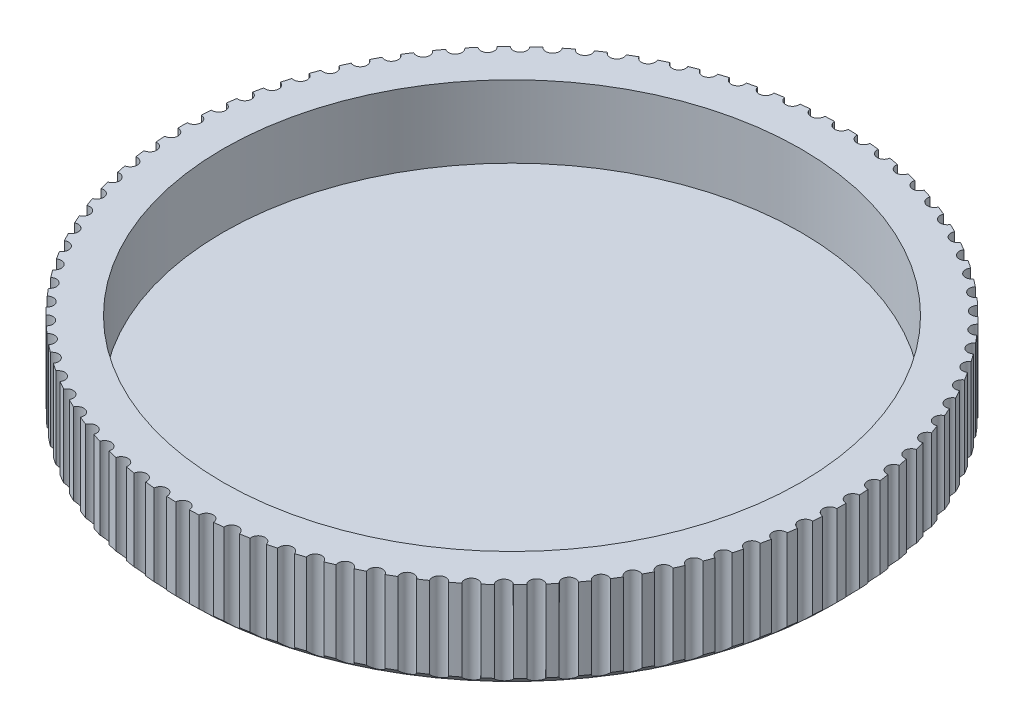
SolidWorks part; units mm, degrees
ref_plane "Front Plane" through (0, 0, 0) normal (0, 0, 1) x (1, 0, 0)
ref_plane "Top Plane" through (0, 0, 0) normal (0, 1, 0) x (1, 0, 0)
ref_plane "Right Plane" through (0, 0, 0) normal (1, 0, 0) x (0, 0, -1)
sketch "Sketch1" plane through (0, 0, 0) normal (0, 1, 0) x (1, 0, 0)
  circle A0 centre (0, 0) radius 36.5
  dimension "D1" = 73
extrude "Boss-Extrude1" add sketch "Sketch1" along normal mid plane 10 contours A0
sketch "Sketch3" plane through (0, 5, 0) normal (0, 1, 0) x (1, 0, 0)
  circle A0 centre (0, 0) radius 32
  dimension "D1" = 64
extrude "Cut-Extrude1" cut sketch "Sketch3" against normal blind 8
chamfer "Chamfer1" distance 1 angle 45 1 edges at (0, -5, 36.5)
sketch "Sketch12" plane through (0, 5, 0) normal (0, 1, 0) x (1, 0, 0)
  line L0 (0, 0) -> (0, 50.0582) construction
  line L1 (0.7532, 36.4922) -> (-0.7532, 36.4922)
  line L2 (3.2969, 36.3508) -> (1.7942, 36.4559)
  line L3 (5.8246, 36.0323) -> (4.3329, 36.2419)
  line L4 (8.3239, 35.5382) -> (6.8504, 35.8514)
  line L5 (10.7826, 34.871) -> (9.3346, 35.2862)
  line L6 (13.1888, 34.0339) -> (11.7733, 34.5491)
  line L7 (15.5308, 33.031) -> (14.1547, 33.6437)
  line L8 (17.7971, 31.8671) -> (16.467, 32.5743)
  line L9 (19.9767, 30.548) -> (18.6992, 31.3463)
  line L10 (22.0589, 29.0801) -> (20.8403, 29.9655)
  line L11 (24.0337, 27.4705) -> (22.8798, 28.4388)
  line L12 (25.8914, 25.7271) -> (24.8078, 26.7735)
  line L13 (27.623, 23.8583) -> (26.615, 24.9778)
  line L14 (29.22, 21.8733) -> (28.2926, 23.0604)
  line L15 (30.6746, 19.7818) -> (29.8323, 21.0306)
  line L16 (31.9798, 17.5938) -> (31.2266, 18.8984)
  line L17 (33.1292, 15.3202) -> (32.4688, 16.6741)
  line L18 (34.1172, 12.9719) -> (33.5529, 14.3686)
  line L19 (34.9389, 10.5604) -> (34.4734, 11.993)
  line L20 (35.5905, 8.0975) -> (35.226, 9.5591)
  line L21 (36.0686, 5.5951) -> (35.807, 7.0786)
  line L22 (36.371, 3.0654) -> (36.2136, 4.5635)
  line L23 (36.4963, 0.5208) -> (36.4437, 2.0263)
  line L24 (36.4437, -2.0263) -> (36.4963, -0.5208)
  line L25 (36.2136, -4.5635) -> (36.371, -3.0654)
  line L26 (35.807, -7.0786) -> (36.0686, -5.5951)
  line L27 (35.226, -9.5591) -> (35.5905, -8.0975)
  line L28 (34.4734, -11.993) -> (34.9389, -10.5604)
  line L29 (33.5529, -14.3686) -> (34.1172, -12.9719)
  line L30 (32.4688, -16.6741) -> (33.1292, -15.3202)
  line L31 (31.2266, -18.8984) -> (31.9798, -17.5938)
  line L32 (29.8323, -21.0306) -> (30.6746, -19.7818)
  line L33 (28.2926, -23.0604) -> (29.22, -21.8733)
  line L34 (26.615, -24.9778) -> (27.623, -23.8583)
  line L35 (24.8078, -26.7735) -> (25.8914, -25.7271)
  line L36 (22.8798, -28.4388) -> (24.0337, -27.4705)
  line L37 (20.8403, -29.9655) -> (22.0589, -29.0801)
  line L38 (18.6992, -31.3463) -> (19.9767, -30.548)
  line L39 (16.467, -32.5743) -> (17.7971, -31.8671)
  line L40 (14.1547, -33.6437) -> (15.5308, -33.031)
  line L41 (11.7733, -34.5491) -> (13.1888, -34.0339)
  line L42 (9.3346, -35.2862) -> (10.7826, -34.871)
  line L43 (6.8504, -35.8514) -> (8.3239, -35.5382)
  line L44 (4.3329, -36.2419) -> (5.8246, -36.0323)
  line L45 (1.7942, -36.4559) -> (3.2969, -36.3508)
  line L46 (-0.7532, -36.4922) -> (0.7532, -36.4922)
  line L47 (-3.2969, -36.3508) -> (-1.7942, -36.4559)
  line L48 (-5.8246, -36.0323) -> (-4.3329, -36.2419)
  line L49 (-8.3239, -35.5382) -> (-6.8504, -35.8514)
  line L50 (-10.7826, -34.871) -> (-9.3346, -35.2862)
  line L51 (-13.1888, -34.0339) -> (-11.7733, -34.5491)
  line L52 (-15.5308, -33.031) -> (-14.1547, -33.6437)
  line L53 (-17.7971, -31.8671) -> (-16.467, -32.5743)
  line L54 (-19.9767, -30.548) -> (-18.6992, -31.3463)
  line L55 (-22.0589, -29.0801) -> (-20.8403, -29.9655)
  line L56 (-24.0337, -27.4705) -> (-22.8798, -28.4388)
  line L57 (-25.8914, -25.7271) -> (-24.8078, -26.7735)
  line L58 (-27.623, -23.8583) -> (-26.615, -24.9778)
  line L59 (-29.22, -21.8733) -> (-28.2926, -23.0604)
  line L60 (-30.6746, -19.7818) -> (-29.8323, -21.0306)
  line L61 (-31.9798, -17.5938) -> (-31.2266, -18.8984)
  line L62 (-33.1292, -15.3202) -> (-32.4688, -16.6741)
  line L63 (-34.1172, -12.9719) -> (-33.5529, -14.3686)
  line L64 (-34.9389, -10.5604) -> (-34.4734, -11.993)
  line L65 (-35.5905, -8.0975) -> (-35.226, -9.5591)
  line L66 (-36.0686, -5.5951) -> (-35.807, -7.0786)
  line L67 (-36.371, -3.0654) -> (-36.2136, -4.5635)
  line L68 (-36.4963, -0.5208) -> (-36.4437, -2.0263)
  line L69 (-36.4437, 2.0263) -> (-36.4963, 0.5208)
  line L70 (-36.2136, 4.5635) -> (-36.371, 3.0654)
  line L71 (-35.807, 7.0786) -> (-36.0686, 5.5951)
  line L72 (-35.226, 9.5591) -> (-35.5905, 8.0975)
  line L73 (-34.4734, 11.993) -> (-34.9389, 10.5604)
  line L74 (-33.5529, 14.3686) -> (-34.1172, 12.9719)
  line L75 (-32.4688, 16.6741) -> (-33.1292, 15.3202)
  line L76 (-31.2266, 18.8984) -> (-31.9798, 17.5938)
  line L77 (-29.8323, 21.0306) -> (-30.6746, 19.7818)
  line L78 (-28.2926, 23.0604) -> (-29.22, 21.8733)
  line L79 (-26.615, 24.9778) -> (-27.623, 23.8583)
  line L80 (-24.8078, 26.7735) -> (-25.8914, 25.7271)
  line L81 (-22.8798, 28.4388) -> (-24.0337, 27.4705)
  line L82 (-20.8403, 29.9655) -> (-22.0589, 29.0801)
  line L83 (-18.6992, 31.3463) -> (-19.9767, 30.548)
  line L84 (-16.467, 32.5743) -> (-17.7971, 31.8671)
  line L85 (-14.1547, 33.6437) -> (-15.5308, 33.031)
  line L86 (-11.7733, 34.5491) -> (-13.1888, 34.0339)
  line L87 (-9.3346, 35.2862) -> (-10.7826, 34.871)
  line L88 (-6.8504, 35.8514) -> (-8.3239, 35.5382)
  line L89 (-4.3329, 36.2419) -> (-5.8246, 36.0323)
  line L90 (-1.7942, 36.4559) -> (-3.2969, 36.3508)
  arc A0 (-0.7532, 36.4922) -> (0.7532, 36.4922) centre (0, 36.5) ccw
  circle A1 centre (0, 0) radius 36.5 construction
  arc A2 (1.7942, 36.4559) -> (3.2969, 36.3508) centre (2.5461, 36.4111) ccw
  arc A3 (4.3329, 36.2419) -> (5.8246, 36.0323) centre (5.0798, 36.1448) ccw
  arc A4 (6.8504, 35.8514) -> (8.3239, 35.5382) centre (7.5888, 35.7024) ccw
  arc A5 (9.3346, 35.2862) -> (10.7826, 34.871) centre (10.0608, 35.0861) ccw
  arc A6 (11.7733, 34.5491) -> (13.1888, 34.0339) centre (12.4837, 34.2988) ccw
  arc A7 (14.1547, 33.6437) -> (15.5308, 33.031) centre (14.8459, 33.3444) ccw
  arc A8 (16.467, 32.5743) -> (17.7971, 31.8671) centre (17.1357, 32.2276) ccw
  arc A9 (18.6992, 31.3463) -> (19.9767, 30.548) centre (19.3421, 30.9538) ccw
  arc A10 (20.8403, 29.9655) -> (22.0589, 29.0801) centre (21.4542, 29.5291) ccw
  arc A11 (22.8798, 28.4388) -> (24.0337, 27.4705) centre (23.4617, 27.9606) ccw
  arc A12 (24.8078, 26.7735) -> (25.8914, 25.7271) centre (25.355, 26.2559) ccw
  arc A13 (26.615, 24.9778) -> (27.623, 23.8583) centre (27.1248, 24.4233) ccw
  arc A14 (28.2926, 23.0604) -> (29.22, 21.8733) centre (28.7624, 22.4716) ccw
  arc A15 (29.8323, 21.0306) -> (30.6746, 19.7818) centre (30.2599, 20.4105) ccw
  arc A16 (31.2266, 18.8984) -> (31.9798, 17.5938) centre (31.6099, 18.25) ccw
  arc A17 (32.4688, 16.6741) -> (33.1292, 15.3202) centre (32.806, 16.0005) ccw
  arc A18 (33.5529, 14.3686) -> (34.1172, 12.9719) centre (33.8422, 13.6731) ccw
  arc A19 (34.4734, 11.993) -> (34.9389, 10.5604) centre (34.7136, 11.2791) ccw
  arc A20 (35.226, 9.5591) -> (35.5905, 8.0975) centre (35.4158, 8.8301) ccw
  arc A21 (35.807, 7.0786) -> (36.0686, 5.5951) centre (35.9455, 6.3382) ccw
  arc A22 (36.2136, 4.5635) -> (36.371, 3.0654) centre (36.3, 3.8153) ccw
  arc A23 (36.4437, 2.0263) -> (36.4963, 0.5208) centre (36.4778, 1.2738) ccw
  arc A24 (36.4963, -0.5208) -> (36.4437, -2.0263) centre (36.4778, -1.2738) ccw
  arc A25 (36.371, -3.0654) -> (36.2136, -4.5635) centre (36.3, -3.8153) ccw
  arc A26 (36.0686, -5.5951) -> (35.807, -7.0786) centre (35.9455, -6.3382) ccw
  arc A27 (35.5905, -8.0975) -> (35.226, -9.5591) centre (35.4158, -8.8301) ccw
  arc A28 (34.9389, -10.5604) -> (34.4734, -11.993) centre (34.7136, -11.2791) ccw
  arc A29 (34.1172, -12.9719) -> (33.5529, -14.3686) centre (33.8422, -13.6731) ccw
  arc A30 (33.1292, -15.3202) -> (32.4688, -16.6741) centre (32.806, -16.0005) ccw
  arc A31 (31.9798, -17.5938) -> (31.2266, -18.8984) centre (31.6099, -18.25) ccw
  arc A32 (30.6746, -19.7818) -> (29.8323, -21.0306) centre (30.2599, -20.4105) ccw
  arc A33 (29.22, -21.8733) -> (28.2926, -23.0604) centre (28.7624, -22.4716) ccw
  arc A34 (27.623, -23.8583) -> (26.615, -24.9778) centre (27.1248, -24.4233) ccw
  arc A35 (25.8914, -25.7271) -> (24.8078, -26.7735) centre (25.355, -26.2559) ccw
  arc A36 (24.0337, -27.4705) -> (22.8798, -28.4388) centre (23.4617, -27.9606) ccw
  arc A37 (22.0589, -29.0801) -> (20.8403, -29.9655) centre (21.4542, -29.5291) ccw
  arc A38 (19.9767, -30.548) -> (18.6992, -31.3463) centre (19.3421, -30.9538) ccw
  arc A39 (17.7971, -31.8671) -> (16.467, -32.5743) centre (17.1357, -32.2276) ccw
  arc A40 (15.5308, -33.031) -> (14.1547, -33.6437) centre (14.8459, -33.3444) ccw
  arc A41 (13.1888, -34.0339) -> (11.7733, -34.5491) centre (12.4837, -34.2988) ccw
  arc A42 (10.7826, -34.871) -> (9.3346, -35.2862) centre (10.0608, -35.0861) ccw
  arc A43 (8.3239, -35.5382) -> (6.8504, -35.8514) centre (7.5888, -35.7024) ccw
  arc A44 (5.8246, -36.0323) -> (4.3329, -36.2419) centre (5.0798, -36.1448) ccw
  arc A45 (3.2969, -36.3508) -> (1.7942, -36.4559) centre (2.5461, -36.4111) ccw
  arc A46 (0.7532, -36.4922) -> (-0.7532, -36.4922) centre (0, -36.5) ccw
  arc A47 (-1.7942, -36.4559) -> (-3.2969, -36.3508) centre (-2.5461, -36.4111) ccw
  arc A48 (-4.3329, -36.2419) -> (-5.8246, -36.0323) centre (-5.0798, -36.1448) ccw
  arc A49 (-6.8504, -35.8514) -> (-8.3239, -35.5382) centre (-7.5888, -35.7024) ccw
  arc A50 (-9.3346, -35.2862) -> (-10.7826, -34.871) centre (-10.0608, -35.0861) ccw
  arc A51 (-11.7733, -34.5491) -> (-13.1888, -34.0339) centre (-12.4837, -34.2988) ccw
  arc A52 (-14.1547, -33.6437) -> (-15.5308, -33.031) centre (-14.8459, -33.3444) ccw
  arc A53 (-16.467, -32.5743) -> (-17.7971, -31.8671) centre (-17.1357, -32.2276) ccw
  arc A54 (-18.6992, -31.3463) -> (-19.9767, -30.548) centre (-19.3421, -30.9538) ccw
  arc A55 (-20.8403, -29.9655) -> (-22.0589, -29.0801) centre (-21.4542, -29.5291) ccw
  arc A56 (-22.8798, -28.4388) -> (-24.0337, -27.4705) centre (-23.4617, -27.9606) ccw
  arc A57 (-24.8078, -26.7735) -> (-25.8914, -25.7271) centre (-25.355, -26.2559) ccw
  arc A58 (-26.615, -24.9778) -> (-27.623, -23.8583) centre (-27.1248, -24.4233) ccw
  arc A59 (-28.2926, -23.0604) -> (-29.22, -21.8733) centre (-28.7624, -22.4716) ccw
  arc A60 (-29.8323, -21.0306) -> (-30.6746, -19.7818) centre (-30.2599, -20.4105) ccw
  arc A61 (-31.2266, -18.8984) -> (-31.9798, -17.5938) centre (-31.6099, -18.25) ccw
  arc A62 (-32.4688, -16.6741) -> (-33.1292, -15.3202) centre (-32.806, -16.0005) ccw
  arc A63 (-33.5529, -14.3686) -> (-34.1172, -12.9719) centre (-33.8422, -13.6731) ccw
  arc A64 (-34.4734, -11.993) -> (-34.9389, -10.5604) centre (-34.7136, -11.2791) ccw
  arc A65 (-35.226, -9.5591) -> (-35.5905, -8.0975) centre (-35.4158, -8.8301) ccw
  arc A66 (-35.807, -7.0786) -> (-36.0686, -5.5951) centre (-35.9455, -6.3382) ccw
  arc A67 (-36.2136, -4.5635) -> (-36.371, -3.0654) centre (-36.3, -3.8153) ccw
  arc A68 (-36.4437, -2.0263) -> (-36.4963, -0.5208) centre (-36.4778, -1.2738) ccw
  arc A69 (-36.4963, 0.5208) -> (-36.4437, 2.0263) centre (-36.4778, 1.2738) ccw
  arc A70 (-36.371, 3.0654) -> (-36.2136, 4.5635) centre (-36.3, 3.8153) ccw
  arc A71 (-36.0686, 5.5951) -> (-35.807, 7.0786) centre (-35.9455, 6.3382) ccw
  arc A72 (-35.5905, 8.0975) -> (-35.226, 9.5591) centre (-35.4158, 8.8301) ccw
  arc A73 (-34.9389, 10.5604) -> (-34.4734, 11.993) centre (-34.7136, 11.2791) ccw
  arc A74 (-34.1172, 12.9719) -> (-33.5529, 14.3686) centre (-33.8422, 13.6731) ccw
  arc A75 (-33.1292, 15.3202) -> (-32.4688, 16.6741) centre (-32.806, 16.0005) ccw
  arc A76 (-31.9798, 17.5938) -> (-31.2266, 18.8984) centre (-31.6099, 18.25) ccw
  arc A77 (-30.6746, 19.7818) -> (-29.8323, 21.0306) centre (-30.2599, 20.4105) ccw
  arc A78 (-29.22, 21.8733) -> (-28.2926, 23.0604) centre (-28.7624, 22.4716) ccw
  arc A79 (-27.623, 23.8583) -> (-26.615, 24.9778) centre (-27.1248, 24.4233) ccw
  arc A80 (-25.8914, 25.7271) -> (-24.8078, 26.7735) centre (-25.355, 26.2559) ccw
  arc A81 (-24.0337, 27.4705) -> (-22.8798, 28.4388) centre (-23.4617, 27.9606) ccw
  arc A82 (-22.0589, 29.0801) -> (-20.8403, 29.9655) centre (-21.4542, 29.5291) ccw
  arc A83 (-19.9767, 30.548) -> (-18.6992, 31.3463) centre (-19.3421, 30.9538) ccw
  arc A84 (-17.7971, 31.8671) -> (-16.467, 32.5743) centre (-17.1357, 32.2276) ccw
  arc A85 (-15.5308, 33.031) -> (-14.1547, 33.6437) centre (-14.8459, 33.3444) ccw
  arc A86 (-13.1888, 34.0339) -> (-11.7733, 34.5491) centre (-12.4837, 34.2988) ccw
  arc A87 (-10.7826, 34.871) -> (-9.3346, 35.2862) centre (-10.0608, 35.0861) ccw
  arc A88 (-8.3239, 35.5382) -> (-6.8504, 35.8514) centre (-7.5888, 35.7024) ccw
  arc A89 (-5.8246, 36.0323) -> (-4.3329, 36.2419) centre (-5.0798, 36.1448) ccw
  arc A90 (-3.2969, 36.3508) -> (-1.7942, 36.4559) centre (-2.5461, 36.4111) ccw
  dimension "D1" = 90
extrude "Cut-Extrude3" cut sketch "Sketch12" against normal up to next
